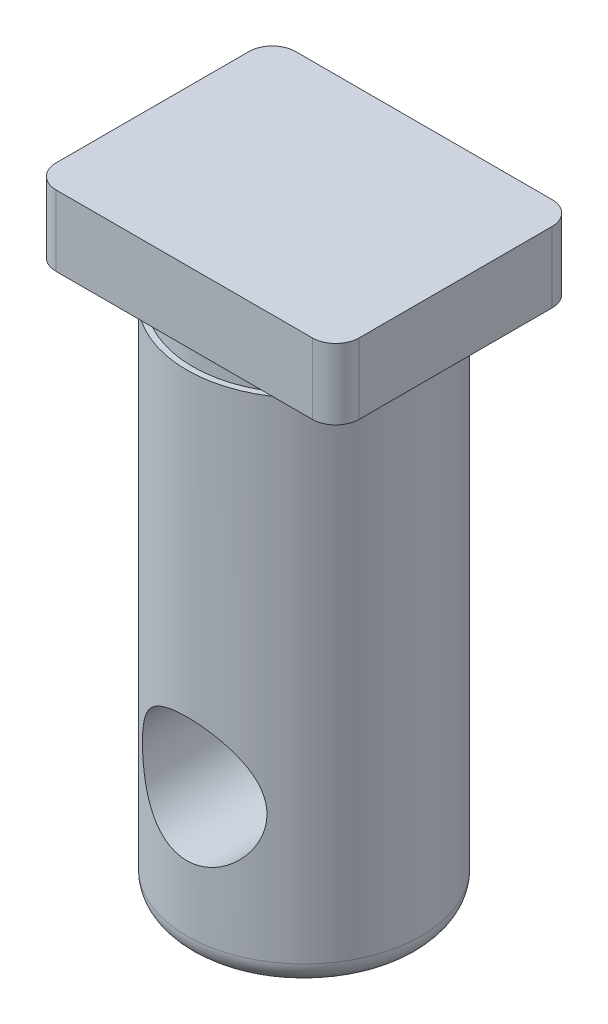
SolidWorks part; units mm, degrees
ref_plane "front" through (0, 0, 0) normal (0, 0, 1) x (1, 0, 0)
ref_plane "top" through (0, 0, 0) normal (0, 1, 0) x (1, 0, 0)
ref_plane "side" through (0, 0, 0) normal (1, 0, 0) x (0, 0, -1)
sketch "Sketch1" plane through (0, 0, 0) normal (0, 1, 0) x (1, 0, 0)
  circle A0 centre (0, 0) radius 3.9434
  dimension "D1" = 7.8867
extrude "Boss-Extrude1" add sketch "Sketch1" along normal blind 20.4216
sketch "Sketch2" plane through (0, 20.4216, 0) normal (0, 1, 0) x (1, 0, 0)
  circle A0 centre (0, 0) radius 3.7465
  circle A1 centre (0, 0) radius 3.9434 construction
  circle A2 centre (0, 0) radius 3.9434
  dimension "D1" = 7.493
extrude "Cut-Extrude1" cut sketch "Sketch2" against normal blind 3.1369
sketch "Sketch3" plane through (0, 20.4216, 0) normal (0, 1, 0) x (1, 0, 0)
  line L0 (0, -50) -> (0, 50) construction
  line L1 (-4.3127, 4.0322) -> (4.3127, 4.0323)
  line L2 (-5.1001, 3.2448) -> (-5.1001, -3.2448)
  line L3 (-4.3127, -4.0323) -> (4.3127, -4.0323)
  line L4 (5.1001, 3.2448) -> (5.1001, -3.2448)
  line L5 (-50, 0) -> (50, 0) construction
  arc A0 (4.3127, 4.0323) -> (5.1001, 3.2448) centre (4.3127, 3.2449) cw
  arc A1 (-5.1001, -3.2448) -> (-4.3127, -4.0323) centre (-4.3127, -3.2449) ccw
  arc A2 (4.3127, -4.0323) -> (5.1001, -3.2448) centre (4.3127, -3.2449) ccw
  arc A3 (-4.3127, 4.0322) -> (-5.1001, 3.2448) centre (-4.3127, 3.2448) ccw
  point P4 (0, 4.0323)
  point P7 (5.1001, 0)
  point P12 (5.1001, 4.0323)
  point P15 (-5.1001, -4.0323)
  point P20 (-5.1001, 4.0322)
  dimension "D3" = 0.7874
  dimension "D1" = 10.2001
  dimension "D2" = 8.0645
extrude "Boss-Extrude2" add sketch "Sketch3" against normal blind 2.3749
sketch "Sketch4" plane through (0, 0, 4.0323) normal (0, 0, 1) x (1, 0, 0)
  line L0 (0, -50) -> (0, 50) construction
  line L2 (50, 0) -> (-50, 0) construction
  circle A0 centre (0, 5.08) radius 2.0955
  dimension "D1" = 4.191
  dimension "D2" = 5.08
extrude "Cut-Extrude2" cut sketch "Sketch4" against normal blind 17.6149
fillet "Fillet1" radius 0.7874 1 edges at (0, 0, 3.9434)
